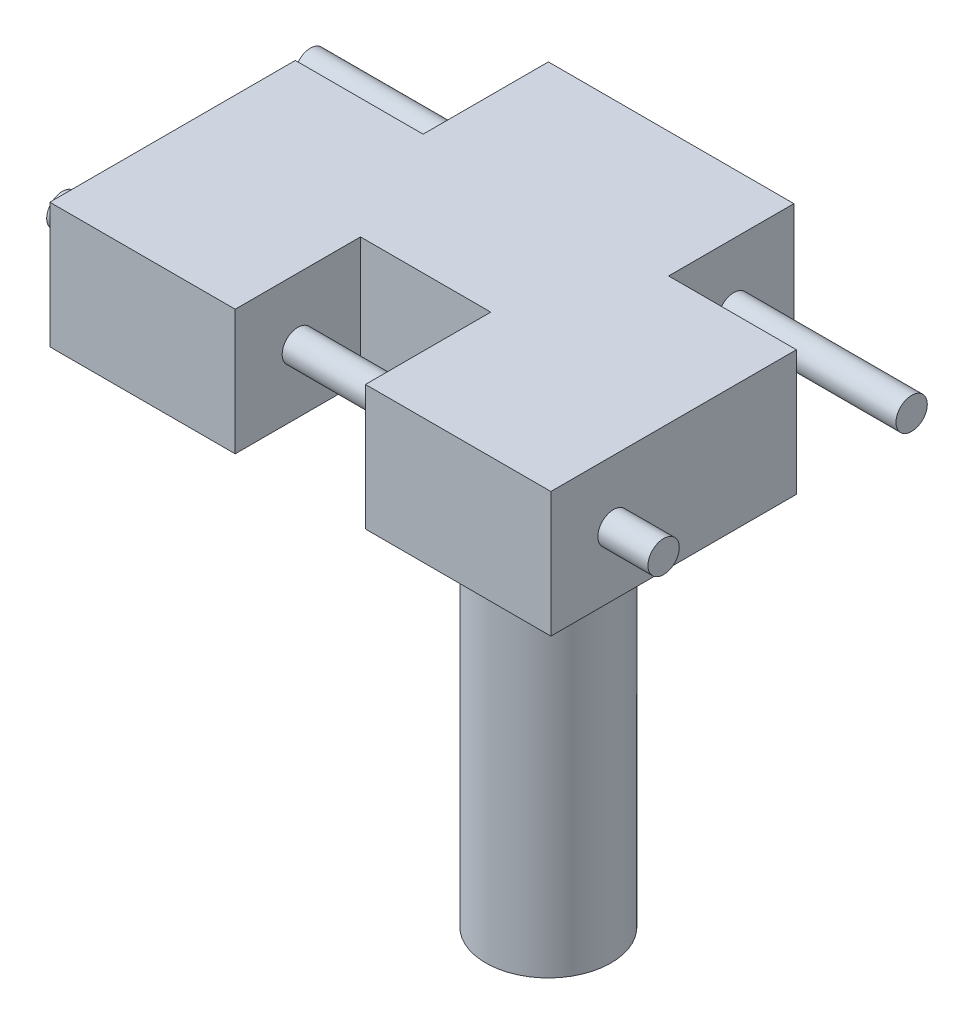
SolidWorks part; units mm, degrees
ref_plane "Front Plane" through (0, 0, 0) normal (0, 0, 1) x (1, 0, 0)
ref_plane "Top Plane" through (0, 0, 0) normal (0, 1, 0) x (1, 0, 0)
ref_plane "Right Plane" through (0, 0, 0) normal (1, 0, 0) x (0, 0, -1)
sketch "Sketch1" plane through (0, 0, 0) normal (0, 1, 0) x (1, 0, 0)
  line L0 (-6.223, 6.223) -> (6.223, 6.223)
  line L1 (6.223, 6.223) -> (6.223, -0.127)
  line L2 (6.223, -0.127) -> (12.7, -0.127)
  line L3 (12.7, -0.127) -> (12.7, -12.573)
  line L4 (12.7, -12.573) -> (3.302, -12.573)
  line L5 (3.302, -12.573) -> (3.302, -6.223)
  line L6 (3.302, -6.223) -> (-3.302, -6.223)
  line L7 (-3.302, -6.223) -> (-3.302, -12.573)
  line L8 (-3.302, -12.573) -> (-12.7, -12.573)
  line L9 (-12.7, -12.573) -> (-12.7, -0.127)
  line L10 (-12.7, -0.127) -> (-6.223, -0.127)
  line L11 (-6.223, -0.127) -> (-6.223, 6.223)
  dimension "D1" = 12.446
  dimension "D2" = 6.35
  dimension "D3" = 12.446
  dimension "D4" = 9.398
  dimension "D5" = 6.35
  dimension "D6" = 6.604
  dimension "D7" = 6.477
  dimension "D8" = 6.223
  dimension "D9" = 6.223
extrude "FingerBase" add sketch "Sketch1" along normal blind 6.35
sketch "Sketch2" plane through (12.7, 0, 0) normal (1, 0, 0) x (0, 0, -1)
  line L0 (-12.573, 6.35) -> (-0.127, 6.35) construction
  line L1 (-12.573, 6.35) -> (-12.573, 0) construction
  line L2 (-0.127, 6.35) -> (6.223, 6.35) construction
  line L3 (6.223, 6.35) -> (6.223, 0) construction
  circle A0 centre (-9.398, 3.175) radius 0.7937
  circle A1 centre (3.175, 3.175) radius 0.7937
  dimension "D1" = 1.5875
  dimension "D2" = 3.175
  dimension "D3" = 3.175
  dimension "D4" = 3.175
  dimension "D5" = 3.048
extrude "Boss-Extrude1" add sketch "Sketch2" along normal blind 2.54 and the other way blind 27.94
sketch "Sketch3" plane through (0, 0, 0) normal (0, -1, 0) x (1, 0, 0)
  circle A0 centre (0, 0) radius 3.175
  dimension "D1" = 6.35
extrude "Boss-Extrude2" add sketch "Sketch3" along normal blind 25.4
